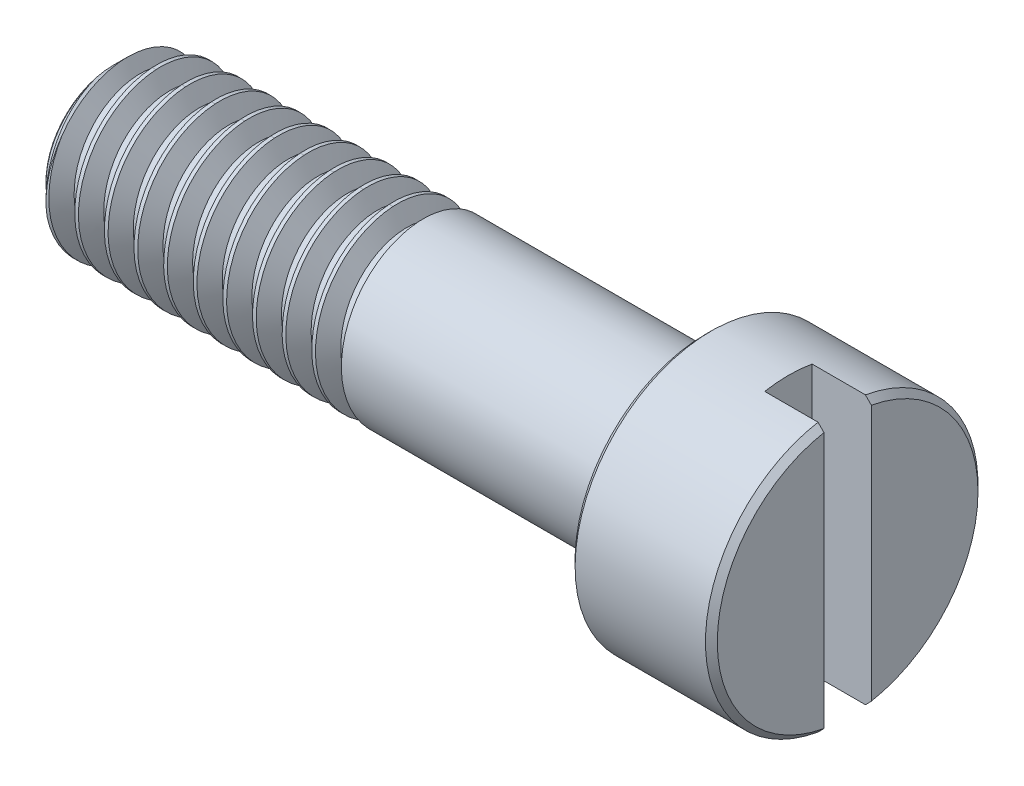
SolidWorks part; units mm, degrees
ref_plane "Front Plane" through (0, 0, 0) normal (0, 0, 1) x (1, 0, 0)
ref_plane "Top Plane" through (0, 0, 0) normal (0, 1, 0) x (1, 0, 0)
ref_plane "Right Plane" through (0, 0, 0) normal (1, 0, 0) x (0, 0, -1)
sketch "Sketch1" plane through (0, 0, 0) normal (0, 0, 1) x (1, 0, 0)
  line L0 (0, 14.7733) -> (0, 0) construction
  line L1 (0, 0) -> (-23.6634, 0) construction
  line L2 (0, 0) -> (-15.748, 0)
  line L3 (-15.748, 0) -> (-15.748, 1.4351)
  line L4 (-15.367, 1.8161) -> (-3.048, 1.8161)
  line L5 (-3.048, 1.8161) -> (-3.048, 2.921)
  line L6 (-3.048, 2.921) -> (0, 2.921)
  line L7 (0, 2.921) -> (0, 0)
  line L8 (-15.748, 1.4351) -> (-15.367, 1.8161)
  point P5 (-1.524, 2.921)
  point P6 (-15.748, 1.8161)
  dimension "D1" = 3.6322
  dimension "D2" = 5.842
  dimension "D3" = 12.7
  dimension "D4" = 3.048
revolve "Revolve1" add sketch "Sketch1" angle 360 about L2
thread "Thread1" pitch 0.635 start angle 0, offset 1.524, length 7.62, pitch 0.635, diameter 3.6322
ref_plane "Plane1" through (-16.891, 0, -1.8161) normal (0, -1, 0) x (0, 0, -1)
sketch "Thread Profile1" plane through (-16.891, 0, -1.8161) normal (0, -1, 0) x (0, 0, -1)
  line L0 (0, 0) -> (0, 0.635) construction
  line L11 (0, 0) -> (0, 0.5556)
  line L12 (0, 0.5556) -> (-0.3437, 0.3572)
  line L13 (-0.3437, 0.3572) -> (-0.3437, 0.1984)
  line L15 (-0.3437, 0.1984) -> (0, 0)
  line L17 (-0.3437, 0.2778) -> (0, 0.2778) construction
  point P2 (0, 0)
  dimension "Pitch" = 0.635
  dimension "Profile_Angle" = 60
  dimension "Profile_Land" = 0.1588
  dimension "Profile_Height" = 0.3437
chamfer "Chamfer1" distance 0.127 angle 45 2 edges at (0, 2.921, 0) (-3.048, 2.921, 0)
sketch "Sketch4" plane through (0, 0, 0) normal (1, 0, 0) x (0, 0, -1)
  line L1 (0.508, -3.175) -> (-0.508, -3.175)
  line L2 (0.508, -3.175) -> (0.508, 3.175)
  line L3 (0.508, 3.175) -> (-0.508, 3.175)
  line L4 (-0.508, -3.175) -> (-0.508, 3.175)
  line L5 (0.508, -3.175) -> (-0.508, 3.175) construction
  line L6 (0.508, 3.175) -> (-0.508, -3.175) construction
  point P0 (0, 0)
  dimension "D1" = 1.016
  dimension "D2" = 6.35
extrude "Cut-Extrude1" cut sketch "Sketch4" against normal blind 1.27
sketch "Sketch5" plane through (0, 0, 0) normal (0, -1, 0) x (1, 0, 0)
  line L4 (-9.0726, -1.4724) -> (-9.271, -1.8161)
  line L5 (-9.271, -1.8161) -> (-8.7154, -1.8161)
  line L6 (-8.7154, -1.8161) -> (-8.9138, -1.4724)
  line L7 (-8.9138, -1.4724) -> (-9.0726, -1.4724)
  line L8 (-9.0726, -1.4724) -> (-9.271, -1.8161)
  line L9 (-9.271, -1.8161) -> (-8.7154, -1.8161)
  line L10 (-8.7154, -1.8161) -> (-8.9138, -1.4724)
  line L11 (-8.9138, -1.4724) -> (-9.0726, -1.4724)
  dimension "D1" = 0
extrude "Cut-Extrude2" cut sketch "Sketch5" against normal up to surface
